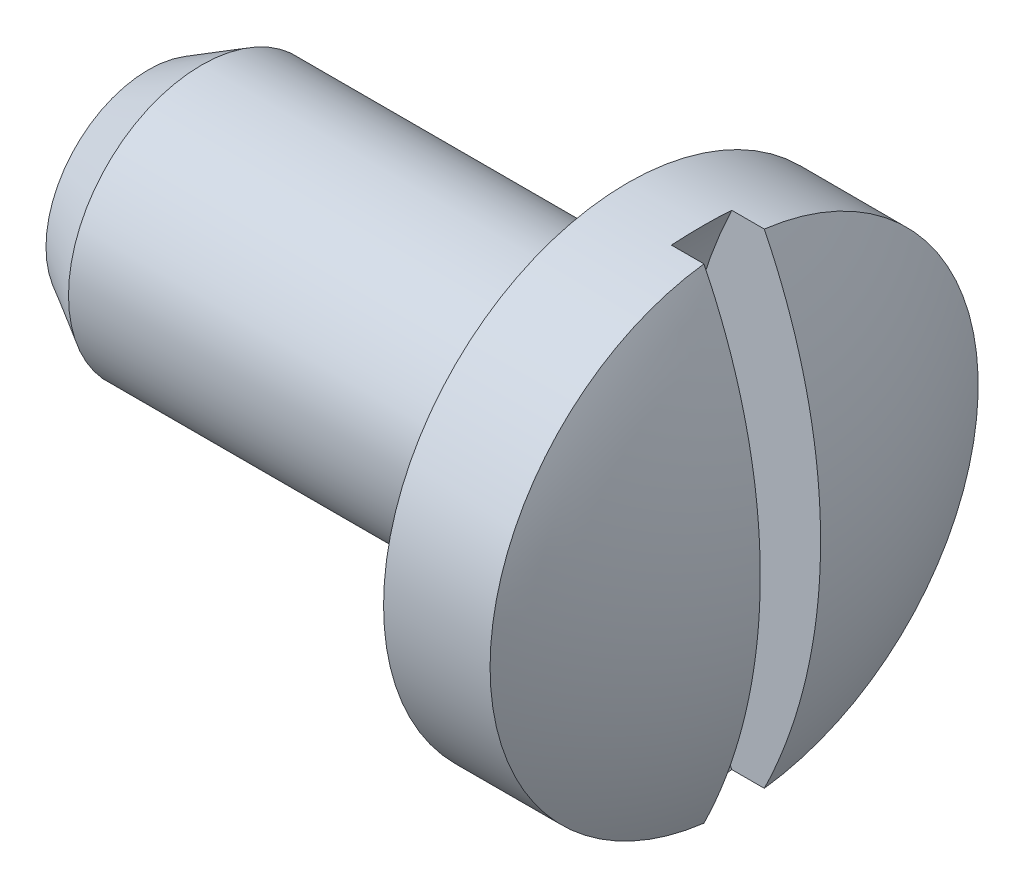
SolidWorks part; units mm, degrees
ref_plane "Front Plane" through (0, 0, 0) normal (0, 0, 1) x (1, 0, 0)
ref_plane "Top Plane" through (0, 0, 0) normal (0, 1, 0) x (1, 0, 0)
ref_plane "Right Plane" through (0, 0, 0) normal (1, 0, 0) x (0, 0, -1)
sketch "Sketch1" plane through (0, 0, 0) normal (0, 0, 1) x (1, 0, 0)
  line L0 (0, 0) -> (109.9944, 0) construction
  line L1 (0, 0) -> (0, 1.4651)
  line L2 (0, 1.4651) -> (0.762, 1.905)
  line L3 (0.762, 1.905) -> (6.604, 1.905)
  line L4 (6.858, 2.159) -> (6.858, 3.4925)
  line L5 (6.858, 3.4925) -> (8.382, 3.4925)
  line L6 (0, 0) -> (9.1989, 0)
  arc A0 (8.382, 3.4925) -> (9.1989, 0) centre (1.3249, 0) cw
  arc A1 (6.858, 2.159) -> (6.604, 1.905) centre (6.604, 2.159) cw
  dimension "D3" = 7.874
  dimension "D6" = 0.254
  dimension "D1" = 0.762
  dimension "D2" = 1.524
  dimension "D4" = 6.858
  dimension "D5" = 30
  dimension "D7" = 6.985
  dimension "D8" = 3.81
revolve "Revolve1" add sketch "Sketch1" angle 360 about L0
sketch "Sketch2" plane through (0, 0, 0) normal (0, 0, 1) x (1, 0, 0)
  line L0 (8.382, 3.4925) -> (6.858, 3.4925) construction
  line L1 (6.858, -3.4925) -> (8.382, -3.4925) construction
  line L2 (7.9289, 3.4925) -> (9.6476, 6.505)
  line L3 (9.6476, 6.505) -> (14.1184, -2.0415)
  line L4 (14.1184, -2.0415) -> (8.2831, -5.3632)
  line L5 (8.2831, -5.3632) -> (7.9289, -3.4925)
  arc A0 (7.9289, 3.4925) -> (7.9289, -3.4925) centre (15.212, 0) ccw
  arc A1 (8.382, -3.4925) -> (8.382, 3.4925) centre (1.3249, 0) ccw construction
  point P3 (9.1989, 0)
  dimension "D1" = 8.0772
  dimension "D2" = 1.27
extrude "Cut-Extrude1" cut sketch "Sketch2" against normal mid plane 0.8636
